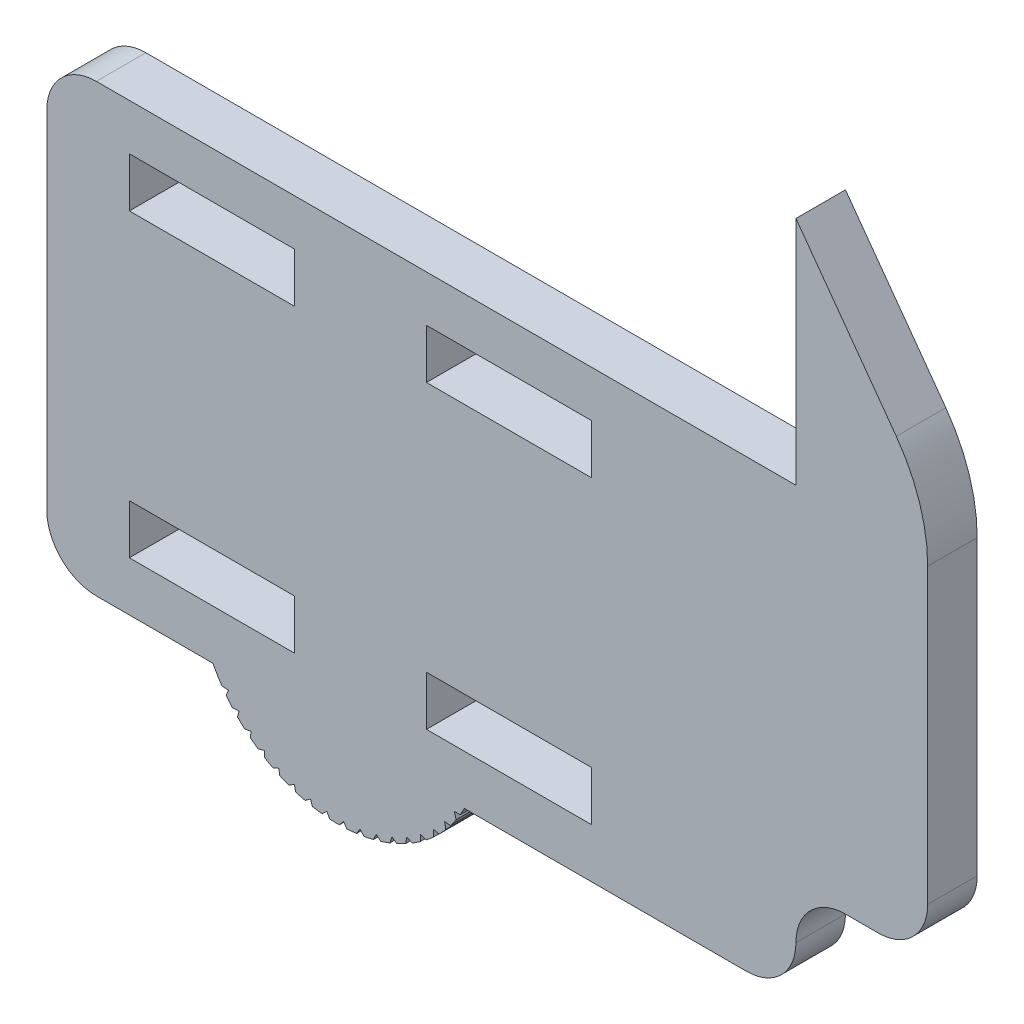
SolidWorks part; units mm, degrees
ref_plane "Plan de face" through (0, 0, 0) normal (0, 0, 1) x (1, 0, 0)
ref_plane "Plan de dessus" through (0, 0, 0) normal (0, 1, 0) x (1, 0, 0)
ref_plane "Plan de droite" through (0, 0, 0) normal (1, 0, 0) x (0, 0, -1)
sketch "Esquisse1" plane through (0, 0, 0) normal (0, 0, 1) x (1, 0, 0)
  line L0 (0, 35) -> (7.9813, 23.9834)
  line L1 (7.9813, 23.9834) -> (7.9813, 0)
  line L2 (7.9813, 0) -> (0, 0)
  line L3 (0, 0) -> (0, -6)
  line L4 (0, -40) -> (0, -0.1) construction
  line L5 (0, -6) -> (-45.3847, -6)
  line L6 (-45.3847, -6) -> (-45.3847, 21)
  line L7 (-45.3847, 21) -> (0, 21)
  line L8 (0, 21) -> (0, 35)
  line L9 (-200, 15) -> (-8, 15) construction
  dimension "D1" = 6
extrude "Boss.-Extru.1" add sketch "Esquisse1" along normal blind 3
sketch "Esquisse2" plane through (0, 0, 0) normal (0, 0, -1) x (-1, 0, 0)
  line L1 (12.3847, 15.2) -> (22.3847, 15.2)
  line L2 (12.3847, 15.2) -> (12.3847, 18.2)
  line L3 (12.3847, 18.2) -> (22.3847, 18.2)
  line L4 (22.3847, 15.2) -> (22.3847, 18.2)
  line L5 (30.3847, 18.2) -> (40.3847, 18.2)
  line L6 (30.3847, 18.2) -> (30.3847, 15.2)
  line L7 (30.3847, 15.2) -> (40.3847, 15.2)
  line L8 (40.3847, 18.2) -> (40.3847, 15.2)
  line L9 (0, 0) -> (200, 0) construction
  line L10 (12.3847, 0) -> (22.3847, 0)
  line L11 (12.3847, 0) -> (12.3847, -3)
  line L12 (12.3847, -3) -> (22.3847, -3)
  line L13 (22.3847, 0) -> (22.3847, -3)
  line L14 (0, 0) -> (-7.9813, 0) construction
  line L15 (30.3847, 0) -> (40.3847, 0)
  line L16 (30.3847, 0) -> (30.3847, -3)
  line L17 (30.3847, -3) -> (40.3847, -3)
  line L18 (40.3847, 0) -> (40.3847, -3)
  line L19 (45.3847, 21) -> (45.3847, -6) construction
  dimension "D1" = 3
  dimension "D2" = 10
  dimension "D3" = 15.2
  dimension "D4" = 5
  dimension "D5" = 8
extrude "Enlèv. mat.-Extru.1" cut sketch "Esquisse2" against normal blind 3
fillet "Congé1" radius 10 1 edges at (7.9813, 23.9834, 1.5)
fillet "Congé2" radius 3 5 edges at (-45.3847, 21, 1.5) (-45.3847, -6, 1.5) (0, -6, 1.5) (0, 0, 1.5) (7.9813, 0, 1.5)
sketch "Esquisse4" plane through (0, 0, 3) normal (0, 0, 1) x (1, 0, 0)
  line L35 (-20.0903, -6) -> (-35.322, -6)
  line L36 (-20.7008, -6.4567) -> (-20.3427, -6.4567)
  line L37 (-20.5831, -6.8385) -> (-20.7008, -6.4567)
  line L38 (-21.2854, -7.2778) -> (-20.93, -7.3215)
  line L39 (-21.2151, -7.6712) -> (-21.2854, -7.2778)
  line L40 (-21.9657, -8.0216) -> (-21.6182, -8.1083)
  line L41 (-21.9438, -8.4206) -> (-21.9657, -8.0216)
  line L42 (-22.7315, -8.677) -> (-22.3972, -8.8053)
  line L43 (-22.7585, -9.0757) -> (-22.7315, -8.677)
  line L44 (-23.5715, -9.2341) -> (-23.2554, -9.4023)
  line L45 (-23.6469, -9.6266) -> (-23.5715, -9.2341)
  line L46 (-24.4732, -9.6848) -> (-24.1799, -9.8902)
  line L47 (-24.5958, -10.0651) -> (-24.4732, -9.6848)
  line L48 (-25.423, -10.0221) -> (-25.1569, -10.2618)
  line L49 (-25.5911, -10.3847) -> (-25.423, -10.0221)
  line L50 (-26.4069, -10.2412) -> (-26.172, -10.5115)
  line L51 (-26.6179, -10.5806) -> (-26.4069, -10.2412)
  line L52 (-27.4102, -10.3388) -> (-27.2099, -10.6357)
  line L53 (-27.6609, -10.65) -> (-27.4102, -10.3388)
  line L54 (-28.4179, -10.3134) -> (-28.2553, -10.6324)
  line L55 (-28.7046, -10.5916) -> (-28.4179, -10.3134)
  line L56 (-29.4149, -10.1653) -> (-29.2924, -10.5018)
  line L57 (-29.7335, -10.4066) -> (-29.4149, -10.1653)
  line L58 (-30.3865, -9.8969) -> (-30.3059, -10.2458)
  line L59 (-30.7321, -10.0975) -> (-30.3865, -9.8969)
  line L60 (-31.3181, -9.512) -> (-31.2807, -9.8682)
  line L61 (-31.6856, -9.669) -> (-31.3181, -9.512)
  line L62 (-32.1959, -9.0165) -> (-32.2021, -9.3745)
  line L63 (-32.5797, -9.1276) -> (-32.1959, -9.0165)
  line L64 (-33.0067, -8.4177) -> (-33.0566, -8.7723)
  line L65 (-33.4013, -8.4812) -> (-33.0067, -8.4177)
  line L66 (-33.7386, -7.7245) -> (-33.8312, -8.0704)
  line L67 (-34.1379, -7.7394) -> (-33.7386, -7.7245)
  line L68 (-34.3805, -6.9474) -> (-34.5146, -7.2794)
  line L69 (-34.7786, -6.9135) -> (-34.3805, -6.9474)
  line L70 (-20.0903, -6) -> (-35.322, -6)
  line L71 (-20.7008, -6.4567) -> (-20.3427, -6.4567)
  line L72 (-20.5831, -6.8385) -> (-20.7008, -6.4567)
  line L73 (-21.2854, -7.2778) -> (-20.93, -7.3215)
  line L74 (-21.2151, -7.6712) -> (-21.2854, -7.2778)
  line L75 (-21.9657, -8.0216) -> (-21.6182, -8.1083)
  line L76 (-21.9438, -8.4206) -> (-21.9657, -8.0216)
  line L77 (-22.7315, -8.677) -> (-22.3972, -8.8053)
  line L78 (-22.7585, -9.0757) -> (-22.7315, -8.677)
  line L79 (-23.5715, -9.2341) -> (-23.2554, -9.4023)
  line L80 (-23.6469, -9.6266) -> (-23.5715, -9.2341)
  line L81 (-24.4732, -9.6848) -> (-24.1799, -9.8902)
  line L82 (-24.5958, -10.0651) -> (-24.4732, -9.6848)
  line L83 (-25.423, -10.0221) -> (-25.1569, -10.2618)
  line L84 (-25.5911, -10.3847) -> (-25.423, -10.0221)
  line L85 (-26.4069, -10.2412) -> (-26.172, -10.5115)
  line L86 (-26.6179, -10.5806) -> (-26.4069, -10.2412)
  line L87 (-27.4102, -10.3388) -> (-27.2099, -10.6357)
  line L88 (-27.6609, -10.65) -> (-27.4102, -10.3388)
  line L89 (-28.4179, -10.3134) -> (-28.2553, -10.6324)
  line L90 (-28.7046, -10.5916) -> (-28.4179, -10.3134)
  line L91 (-29.4149, -10.1653) -> (-29.2924, -10.5018)
  line L92 (-29.7335, -10.4066) -> (-29.4149, -10.1653)
  line L93 (-30.3865, -9.8969) -> (-30.3059, -10.2458)
  line L94 (-30.7321, -10.0975) -> (-30.3865, -9.8969)
  line L95 (-31.3181, -9.512) -> (-31.2807, -9.8682)
  line L96 (-31.6856, -9.669) -> (-31.3181, -9.512)
  line L97 (-32.1959, -9.0165) -> (-32.2021, -9.3745)
  line L98 (-32.5797, -9.1276) -> (-32.1959, -9.0165)
  line L99 (-33.0067, -8.4177) -> (-33.0566, -8.7723)
  line L100 (-33.4013, -8.4812) -> (-33.0067, -8.4177)
  line L101 (-33.7386, -7.7245) -> (-33.8312, -8.0704)
  line L102 (-34.1379, -7.7394) -> (-33.7386, -7.7245)
  line L103 (-34.3805, -6.9474) -> (-34.5146, -7.2794)
  line L104 (-34.7786, -6.9135) -> (-34.3805, -6.9474)
  arc A18 (-20.3427, -6.4567) -> (-20.0903, -6) centre (-27.7061, -2.0885) ccw
  arc A19 (-20.93, -7.3215) -> (-20.5831, -6.8385) centre (-27.7061, -2.0885) ccw
  arc A20 (-21.6182, -8.1083) -> (-21.2151, -7.6712) centre (-27.7061, -2.0885) ccw
  arc A21 (-22.3972, -8.8053) -> (-21.9438, -8.4206) centre (-27.7061, -2.0885) ccw
  arc A22 (-23.2554, -9.4023) -> (-22.7585, -9.0757) centre (-27.7061, -2.0885) ccw
  arc A23 (-24.1799, -9.8902) -> (-23.6469, -9.6266) centre (-27.7061, -2.0885) ccw
  arc A24 (-25.1569, -10.2618) -> (-24.5958, -10.0651) centre (-27.7061, -2.0885) ccw
  arc A25 (-26.172, -10.5115) -> (-25.5911, -10.3847) centre (-27.7061, -2.0885) ccw
  arc A26 (-27.2099, -10.6357) -> (-26.6179, -10.5806) centre (-27.7061, -2.0885) ccw
  arc A27 (-28.2553, -10.6324) -> (-27.6609, -10.65) centre (-27.7061, -2.0885) ccw
  arc A28 (-29.2924, -10.5018) -> (-28.7046, -10.5916) centre (-27.7061, -2.0885) ccw
  arc A29 (-30.3059, -10.2458) -> (-29.7335, -10.4066) centre (-27.7061, -2.0885) ccw
  arc A30 (-31.2807, -9.8682) -> (-30.7321, -10.0975) centre (-27.7061, -2.0885) ccw
  arc A31 (-32.2021, -9.3745) -> (-31.6856, -9.669) centre (-27.7061, -2.0885) ccw
  arc A32 (-33.0566, -8.7723) -> (-32.5797, -9.1276) centre (-27.7061, -2.0885) ccw
  arc A33 (-33.8312, -8.0704) -> (-33.4013, -8.4812) centre (-27.7061, -2.0885) ccw
  arc A34 (-34.5146, -7.2794) -> (-34.1379, -7.7394) centre (-27.7061, -2.0885) ccw
  arc A35 (-35.322, -6) -> (-34.7786, -6.9135) centre (-27.7061, -2.0885) ccw
  arc A36 (-20.3427, -6.4567) -> (-20.0903, -6) centre (-27.7061, -2.0885) ccw
  arc A37 (-20.93, -7.3215) -> (-20.5831, -6.8385) centre (-27.7061, -2.0885) ccw
  arc A38 (-21.6182, -8.1083) -> (-21.2151, -7.6712) centre (-27.7061, -2.0885) ccw
  arc A39 (-22.3972, -8.8053) -> (-21.9438, -8.4206) centre (-27.7061, -2.0885) ccw
  arc A40 (-23.2554, -9.4023) -> (-22.7585, -9.0757) centre (-27.7061, -2.0885) ccw
  arc A41 (-24.1799, -9.8902) -> (-23.6469, -9.6266) centre (-27.7061, -2.0885) ccw
  arc A42 (-25.1569, -10.2618) -> (-24.5958, -10.0651) centre (-27.7061, -2.0885) ccw
  arc A43 (-26.172, -10.5115) -> (-25.5911, -10.3847) centre (-27.7061, -2.0885) ccw
  arc A44 (-27.2099, -10.6357) -> (-26.6179, -10.5806) centre (-27.7061, -2.0885) ccw
  arc A45 (-28.2553, -10.6324) -> (-27.6609, -10.65) centre (-27.7061, -2.0885) ccw
  arc A46 (-29.2924, -10.5018) -> (-28.7046, -10.5916) centre (-27.7061, -2.0885) ccw
  arc A47 (-30.3059, -10.2458) -> (-29.7335, -10.4066) centre (-27.7061, -2.0885) ccw
  arc A48 (-31.2807, -9.8682) -> (-30.7321, -10.0975) centre (-27.7061, -2.0885) ccw
  arc A49 (-32.2021, -9.3745) -> (-31.6856, -9.669) centre (-27.7061, -2.0885) ccw
  arc A50 (-33.0566, -8.7723) -> (-32.5797, -9.1276) centre (-27.7061, -2.0885) ccw
  arc A51 (-33.8312, -8.0704) -> (-33.4013, -8.4812) centre (-27.7061, -2.0885) ccw
  arc A52 (-34.5146, -7.2794) -> (-34.1379, -7.7394) centre (-27.7061, -2.0885) ccw
  arc A53 (-35.322, -6) -> (-34.7786, -6.9135) centre (-27.7061, -2.0885) ccw
  dimension "D1" = 0
extrude "Boss.-Extru.2" add sketch "Esquisse4" against normal blind 3
